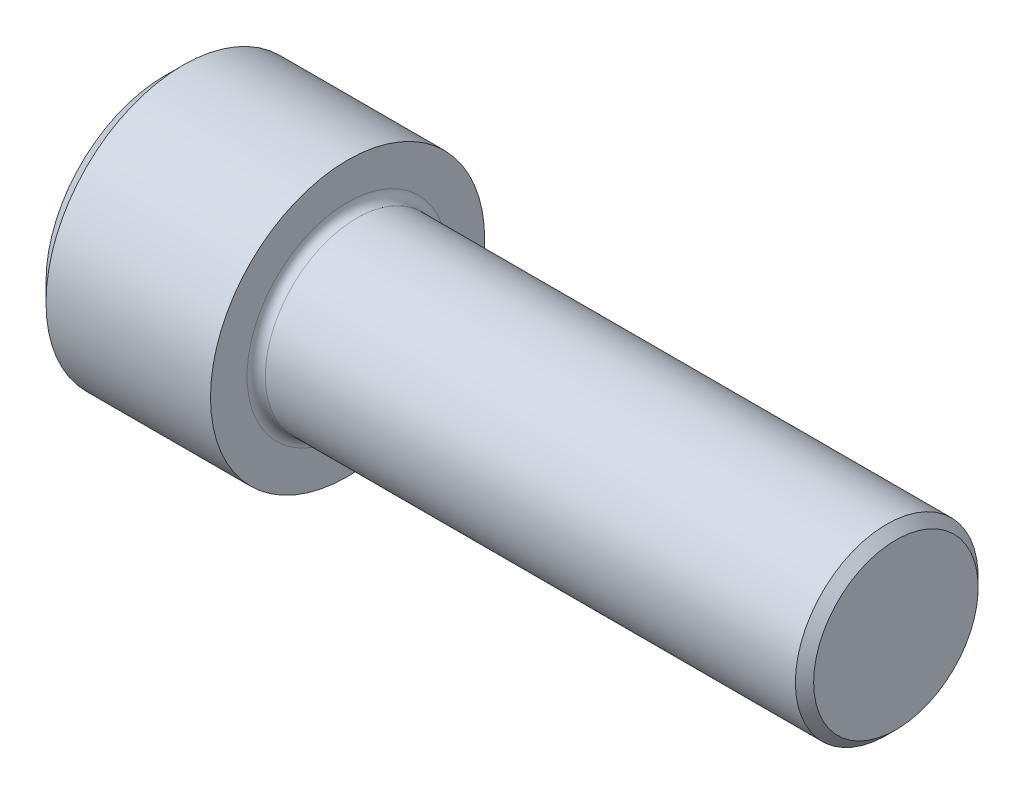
SolidWorks part; units mm, degrees
ref_plane "Plane1" through (0, 0, 0) normal (0, 0, 1) x (1, 0, 0)
ref_plane "Plane2" through (0, 0, 0) normal (0, 1, 0) x (1, 0, 0)
ref_plane "Plane3" through (0, 0, 0) normal (1, 0, 0) x (0, 0, -1)
sketch "BodySke" plane through (0, 0, 0) normal (0, 0, 1) x (1, 0, 0)
  line L0 (0, 0) -> (0, 16.51)
  line L1 (2.54, 19.05) -> (25.4, 19.05)
  line L2 (25.4, 19.05) -> (25.4, 12.7)
  line L3 (25.4, 12.7) -> (100.3313, 12.7)
  line L4 (101.6, 11.4313) -> (101.6, 0)
  line L5 (101.6, 0) -> (0, 0)
  line L6 (-31.75, 0) -> (127, 0) construction
  line L7 (0, 16.51) -> (2.54, 19.05)
  line L8 (101.6, 11.4313) -> (100.3313, 12.7)
  line L9 (0, -16.51) -> (2.54, -19.05) construction
  line L10 (101.6, -11.4313) -> (100.3313, -12.7) construction
  line L11 (27.5167, 9.525) -> (27.5167, 3.175) construction
  line L12 (63.5, 9.525) -> (63.5, 3.175) construction
  line L13 (63.5, 9.525) -> (63.5, 3.175) construction
  dimension "Diameter" = 25.4
  dimension "Head_ht" = 25.4
  dimension "Length" = 76.2
  dimension "Body_ch_ang" = 45
  dimension "Head_dia" = 38.1
  dimension "Head_ch_ang" = 45
  dimension "Head_side_ht" = 22.86
  dimension "Minor_dia" = 22.8625
  dimension "Advance" = 2.1167
  dimension "Thread_nom" = 38.1
  dimension "Thread_length" = 38.1
revolve "Base-Revolve" add sketch "BodySke" angle 360 about L6
fillet "Fillet1" radius 1.27 1 edges at (25.4, 0, 12.7)
sketch "Sketch2" plane through (0, 0, 0) normal (0, 0, 1) x (1, 0, 0)
  line L0 (0, 9.525) -> (12.573, 9.525)
  line L1 (12.573, 9.525) -> (18.0723, 0)
  line L2 (-31.75, 0) -> (127, 0) construction
  line L3 (18.0723, 0) -> (0, 0)
  line L4 (0, 0) -> (0, 9.525)
  line L5 (0, 16.51) -> (0, -16.51) construction
  line L6 (0, 0) -> (47.625, 0) construction
  line L7 (25.4, -19.05) -> (25.4, 19.05) construction
  dimension "D1" = 9.525
  dimension "D2" = 60
  dimension "Wall_thickness" = 12.827
revolve "Hex-PreBroach" cut sketch "Sketch2" angle 360 about L6
sketch "Sketch3" plane through (0, 0, 0) normal (-1, 0, 0) x (0, 0.5, 0.866)
  line L0 (5.4993, 9.525) -> (-5.4993, 9.525)
  line L1 (-5.4993, 9.525) -> (-10.9985, 0)
  line L2 (5.4993, 9.525) -> (10.9985, 0)
  line L3 (5.4993, -9.525) -> (10.9985, 0)
  line L4 (5.4993, -9.525) -> (-5.4993, -9.525)
  line L5 (-5.4993, -9.525) -> (-10.9985, 0)
  dimension "D1" = 9.525
  dimension "D2" = 9.525
  dimension "Hex_size" = 19.05
extrude "Hex" cut sketch "Sketch3" against normal blind 12.573
sketch "Sketch4" plane through (0, 0, 0) normal (-1, 0, 0) x (0, 0, 1)
  line L0 (0, 0) -> (10.1727, 0)
  line L1 (0, 0) -> (6.1484, 3.5498) construction
  line L2 (0, 0) -> (5.0863, 8.8098)
  line L3 (8.4417, 2.1022) -> (9.7612, 2.864)
  line L4 (6.0414, 6.2596) -> (7.3609, 7.0215)
  arc A0 (8.4417, 2.1022) -> (6.0414, 6.2596) centre (0, 0) ccw
  arc A1 (10.1727, 0) -> (9.7612, 2.864) centre (0, 0) ccw
  arc A2 (5.0863, 8.8098) -> (7.3609, 7.0215) centre (0, 0) cw
  dimension "D1" = 30
  dimension "Spline_n_dim" = 17.399
  dimension "Spline_m_dim" = 20.3454
  dimension "D2" = 60
  dimension "D3" = 2.4003
  dimension "Spline_p_dim" = 4.8006
extrude "Spline" [suppressed] cut sketch "Sketch4" against normal blind 12.573
pattern_circular "CirPattern1" [suppressed] count 6 every 60 about axis through (-31.75, 0, 0) along (1, 0, 0)
sketch "Sketch5" plane through (0, 0, 0) normal (0, 0, 1) x (1, 0, 0)
  line L0 (-31.75, 0) -> (127, 0) construction
  line L2 (0, 16.51) -> (0, -16.51) construction
  circle A0 centre (7.874, 0) radius 1.1874
  dimension "Drilled_hole_dia" = 2.3749
  dimension "Drilled_hole_loc" = 7.874
extrude "Hole" [suppressed] cut sketch "Sketch5" against normal through all and the other way through all
pattern_circular "Drilled-4" [suppressed] count 2 every 60 about axis through (-31.75, 0, 0) along (1, 0, 0)
pattern_circular "Drilled-6" [suppressed] count 3 every 60 about axis through (-31.75, 0, 0) along (1, 0, 0)
sketch "ThdSchSke" plane through (0, 0, 0) normal (0, 0, 1) x (1, 0, 0)
  line L0 (63.5, -11.4313) -> (62.6116, -12.7)
  line L1 (63.5, -11.4313) -> (64.3884, -12.7)
  line L2 (64.3884, -12.7) -> (64.3884, -15.875)
  line L3 (-3.175, 0) -> (5.1513, 0) construction
  line L5 (64.3884, -15.875) -> (62.6116, -15.875)
  line L6 (62.6116, -15.875) -> (62.6116, -12.7)
  line L7 (0, 16.51) -> (0, -16.51) construction
  dimension "Thread_minor" = 22.8625
  dimension "Diameter" = 25.4
  dimension "Start" = 63.5
  dimension "SideAngle" = 55
  dimension "VeeAngle" = 70
  dimension "Overcut" = 31.75
revolve "ThreadSchematic" [suppressed] cut sketch "ThdSchSke" angle 360 about L3
pattern_linear "ThdSchPat" [suppressed]
equation "\"D2@Sketch3\" = \"Hex_size@Sketch3\" / 2"
equation "\"D1@Sketch3\" = \"Hex_size@Sketch3\" / 2"
equation "\"D1@Sketch2\" = \"Hex_size@Sketch3\" / 2"
equation "\"D3@Sketch4\" = \"Spline_p_dim@Sketch4\" / 2"
equation "\"Thread_minor@ThreadCosmetic\"  =  \"Minor_dia@BodySke\""
equation "\"D2@CirPattern1\" = 360 / \"Num_teeth@CirPattern1\""
equation "\"Wall_thickness@Sketch2\" = \"Head_ht@BodySke\" - \"Key_eng@Hex\""
equation "\"Thread_length@ThreadCosmetic\" = ((sgn( (\"Length@BodySke\" - \"Advance@BodySke\" ) - \"Thread_nom@BodySke\" )-1)*( (\"Length@BodySke\" - \"Advance@BodySke\" ) - \"Thread_nom@BodySke\" ))/-2+ \"Thread_nom@BodySke\""
equation "\"Thread_minor@ThdSchSke\" = \"Minor_dia@BodySke\""
equation "\"Diameter@ThdSchSke\" = \"Diameter@BodySke\""
equation "\"Overcut@ThdSchSke\" = \"Diameter@BodySke\" * 1.25"
equation "\"Start@ThdSchSke\" = \"Head_ht@BodySke\" + \"Length@BodySke\" - \"Thread_length@ThreadCosmetic\"  '---Non-countersunk---"
equation "\"Num_threads@ThdSchPat\" = int( \"Thread_length@ThreadCosmetic\" / \"Advance@BodySke\" + 0.999 )  + 1"
equation "\"Advance@ThdSchPat\" = \"Thread_length@ThreadCosmetic\" /  (\"Num_threads@ThdSchPat\" - 1) 'relax it"
equation "\"Num_threads@ThdSchPat\" = \"Num_threads@ThdSchPat\" - sgn( \"Num_threads@ThdSchPat\" - 1) '---chamfered tips only---"
